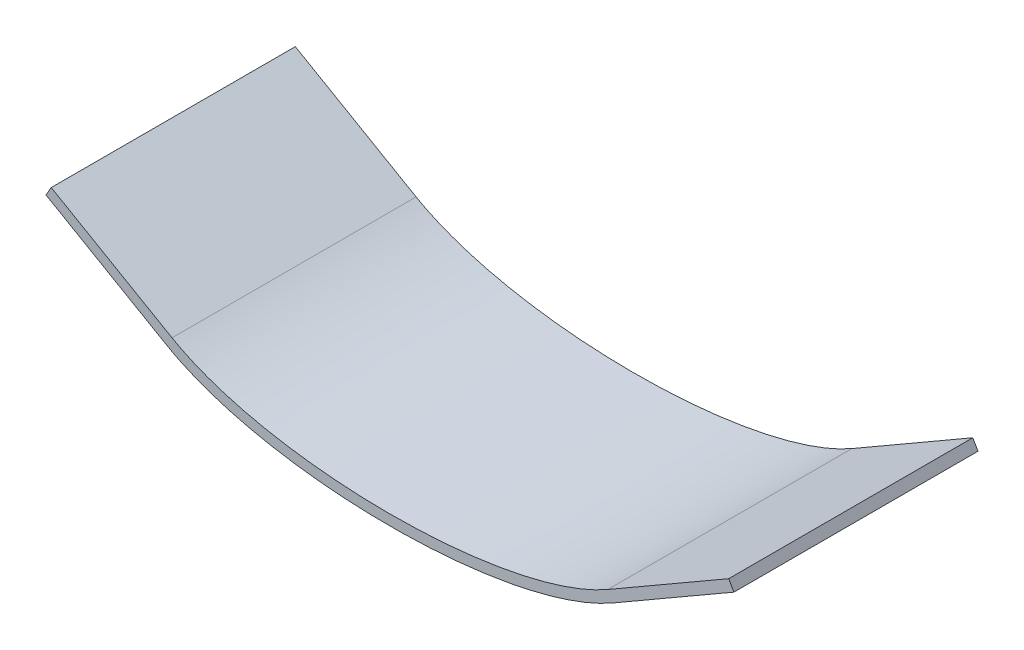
SolidWorks part; units mm, degrees
ref_plane "Front" through (0, 0, 0) normal (0, 0, 1) x (1, 0, 0)
ref_plane "Top" through (0, 0, 0) normal (0, 1, 0) x (1, 0, 0)
ref_plane "Right" through (0, 0, 0) normal (1, 0, 0) x (0, 0, -1)
sketch "Sketch1" plane through (0, 0, 0) normal (0, 0, 1) x (1, 0, 0)
  line L0 (15.875, 0) -> (24.6738, 5.08)
  line L1 (-15.875, 0) -> (-24.6738, 5.08)
  line L2 (-15.875, 0) -> (15.875, 0) construction
  spline S0 degree 3 poles (-15.875, 0) (-8.5427, -4.2333) (8.5427, -4.2333) (15.875, 0) knots 0 0 0 0 1 1 1 1
  point P4 (0, 0)
  point P7 (15.5657, 0)
  dimension "D5" = 25.4
  dimension "D6" = 25.4
  dimension "D7" = 53.0178
  dimension "D1" = 30
  dimension "D2" = 30
  dimension "D3" = 31.75
  dimension "D4" = 10.16
extrude "Extrude-Thin1" add sketch "Sketch1" along normal blind 17.78 thin
